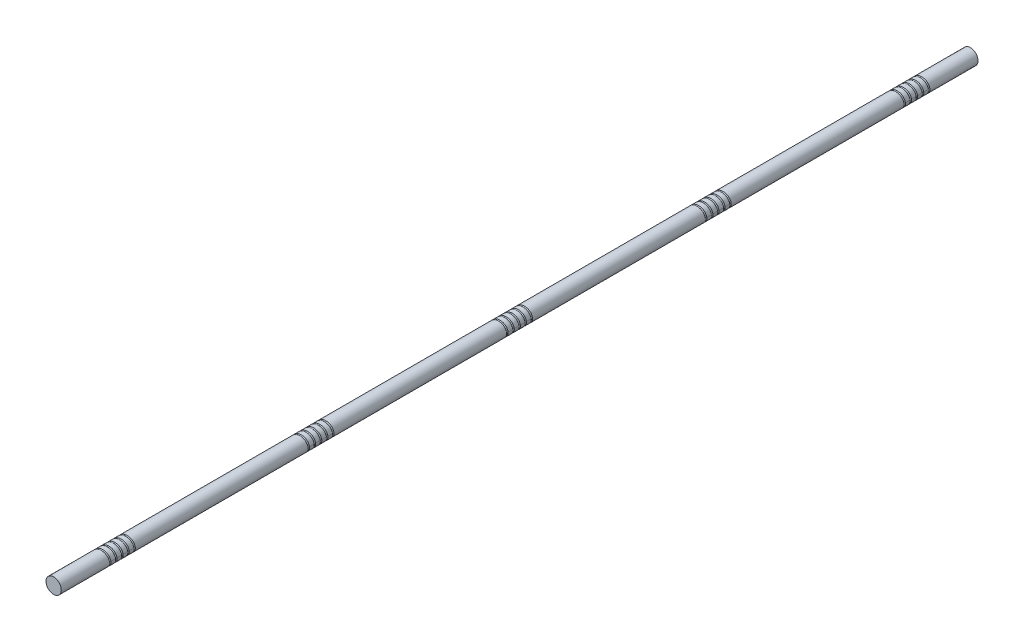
SolidWorks part; units mm, degrees
ref_plane "Front Plane" through (0, 0, 0) normal (0, 0, 1) x (1, 0, 0)
ref_plane "Top Plane" through (0, 0, 0) normal (0, 1, 0) x (1, 0, 0)
ref_plane "Right Plane" through (0, 0, 0) normal (1, 0, 0) x (0, 0, -1)
sketch "Sketch1" plane through (0, 0, 0) normal (0, 0, 1) x (1, 0, 0)
  circle A0 centre (0, 0) radius 25
  dimension "D1" = 50
extrude "Boss-Extrude1" add sketch "Sketch1" along normal blind 3000
ref_plane "Plane1" through (0, 0, 150) normal (0, 0, 1) x (1, 0, 0)
sketch "Sketch2" plane through (0, 0, 150) normal (0, 0, 1) x (1, 0, 0)
  circle A0 centre (0, 0) radius 27.1167
  dimension "D1" = 54.2333
curve "Helix/Spiral1"
sketch "Sketch3" plane through (0, 0, 0) normal (0, 1, 0) x (1, 0, 0)
  circle A0 centre (-27.1167, -150) radius 3.175
  spline S0 degree 3 number of poles 118 (-27.1167, -150) -> (-27.1167, -250) construction
  dimension "D1" = 6.35
sweep "Cut-Sweep1" cut profiles "Sketch3" path "Helix/Spiral1"
pattern_linear "LPattern1" count 5 spacing 650 along (0, 0, -1) of "Cut-Sweep1"
